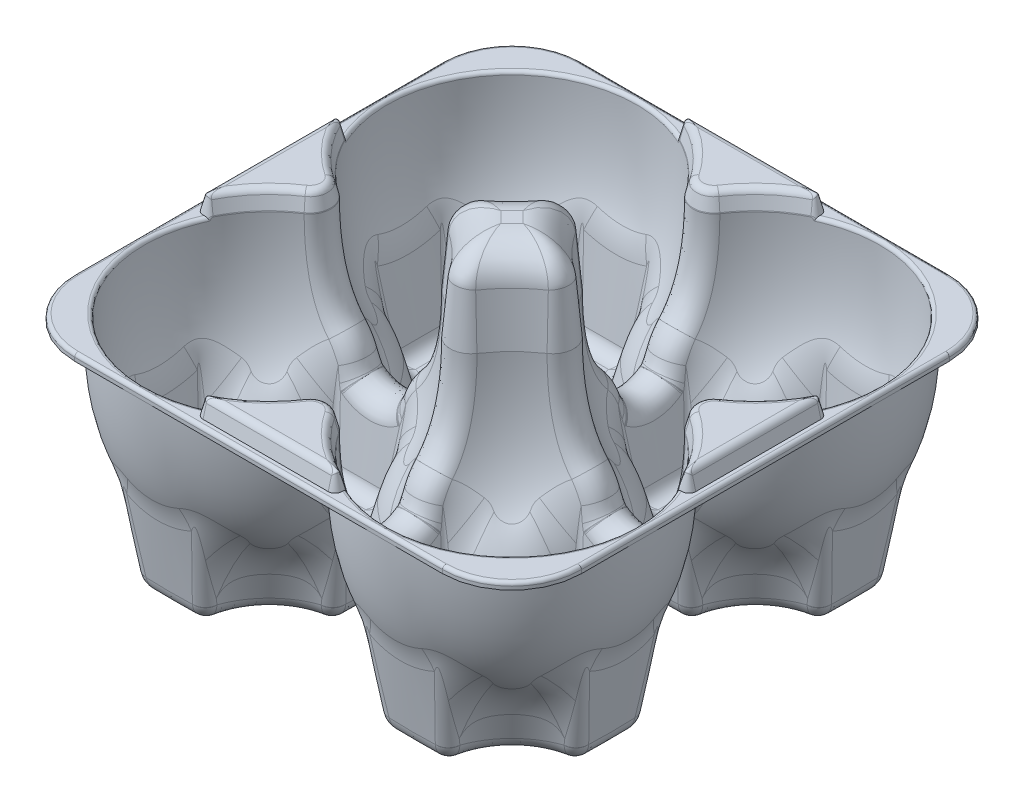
SolidWorks part; units mm, degrees
ref_plane "Front Plane" through (0, 0, 0) normal (0, 0, 1) x (1, 0, 0)
ref_plane "Top Plane" through (0, 0, 0) normal (0, 1, 0) x (1, 0, 0)
ref_plane "Right Plane" through (0, 0, 0) normal (1, 0, 0) x (0, 0, -1)
body saved out of another part "Stock-Eggs carton-1"
